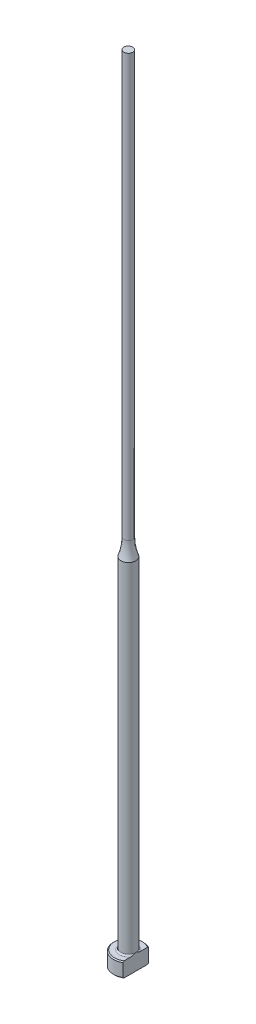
SolidWorks part; units mm, degrees
ref_plane "Front Plane" through (0, 0, 0) normal (0, 0, 1) x (1, 0, 0)
ref_plane "Top Plane" through (0, 0, 0) normal (0, 1, 0) x (1, 0, 0)
ref_plane "Right Plane" through (0, 0, 0) normal (1, 0, 0) x (0, 0, -1)
sketch "Sketch1" plane through (0, 0, 0) normal (0, 0, 1) x (1, 0, 0)
  line L0 (0, 259.9588) -> (0, -15.1925) construction
  line L1 (0, 0) -> (-3, 0)
  line L2 (-3, 0) -> (-3, 3)
  line L3 (-3, 3) -> (-1.5, 3)
  line L4 (-0.9, 75) -> (-0.9, 160)
  line L5 (-0.9, 160) -> (0, 160)
  line L6 (0, 160) -> (0, 0)
  line L7 (-1.5, 3) -> (-1.5, 71.5883)
  arc A0 (-1.5, 71.5883) -> (-0.9, 75) centre (-10.9, 75) ccw
  point P13 (-1.5, 0)
  dimension "D1" = 10
  dimension "L" = 160
  dimension "H" = 6
  dimension "T" = 3
  dimension "D" = 1.8
  dimension "B" = 3
  dimension "S" = 75
revolve "Revolve1" add sketch "Sketch1" angle 360 about L0
chamfer "Chamfer1" distance 0.2 angle 45 2 edges at (0, 3, 3) (0, 0, 3)
fillet "Fillet1" radius 0.3 1 edges at (0, 3, 1.5)
sketch "Sketch2" plane through (0, 0, 0) normal (0, 1, 0) x (1, 0, 0)
  line L0 (1.5, 2.5981) -> (1.5, -2.5981)
  circle A0 centre (0, 0) radius 3 construction
  arc A1 (1.5, -2.5981) -> (1.5, 2.5981) centre (0, 0) ccw
  circle A2 centre (0, 0) radius 1.5 construction
extrude "KEY" cut sketch "Sketch2" along normal through all
